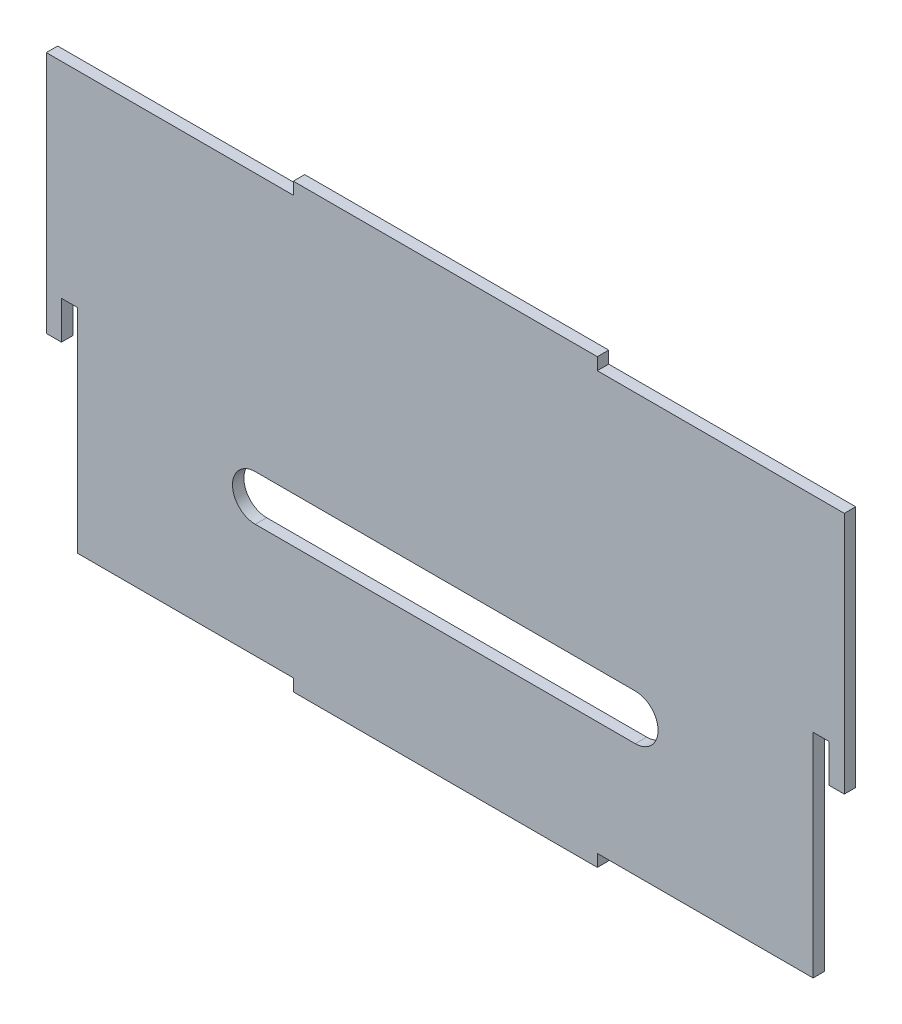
SolidWorks part; units mm, degrees
ref_plane "Plan de face" through (0, 0, 0) normal (0, 0, 1) x (1, 0, 0)
ref_plane "Plan de dessus" through (0, 0, 0) normal (0, 1, 0) x (1, 0, 0)
ref_plane "Plan de droite" through (0, 0, 0) normal (1, 0, 0) x (0, 0, -1)
sketch "Esquisse1" plane through (0, 0, 0) normal (0, 0, 1) x (1, 0, 0)
  line L0 (-52.5, 27.5) -> (52.5, -27.5) construction
  line L2 (-52.5, 27.5) -> (-52.5, -27.5)
  line L3 (-52.5, -27.5) -> (-50.5, -27.5)
  line L4 (52.5, 27.5) -> (52.5, -27.5)
  line L5 (0, 0) -> (0, -53.5236) construction
  line L7 (-20, -27.5) -> (-20, -29.1)
  line L8 (-20, -29.1) -> (20, -29.1)
  line L9 (20, -27.5) -> (20, -29.1)
  line L10 (20, -27.5) -> (48.4, -27.5)
  line L19 (-52.5, 27.5) -> (-20, 27.5)
  line L21 (0, 0) -> (24.5194, 0) construction
  line L22 (20, 27.5) -> (20, 29.1)
  line L23 (-20, 29.1) -> (20, 29.1)
  line L24 (-20, 27.5) -> (-20, 29.1)
  line L25 (20, 27.5) -> (52.5, 27.5)
  line L26 (50.5, 0.5) -> (48.4, 0.5)
  line L28 (-50.5, -27.5) -> (-50.5, 0.5)
  line L29 (-50.5, 0.5) -> (-48.4, 0.5)
  line L30 (-48.4, -27.5) -> (-48.4, 0.5)
  line L31 (48.4, -27.5) -> (48.4, 0.5)
  line L32 (50.5, -27.5) -> (50.5, 0.5)
  line L33 (-48.4, -27.5) -> (-20, -27.5)
  line L34 (50.5, -27.5) -> (52.5, -27.5)
  dimension "D1" = 55
  dimension "D2" = 105
  dimension "D3" = 40
  dimension "D4" = 1.6
  dimension "D5" = 28
  dimension "D6" = 2.1
  dimension "D7" = 2
extrude "Boss.-Extru.1" add sketch "Esquisse1" along normal blind 1.5
sketch "Esquisse2" plane through (0, 0, 0) normal (0, 0, 1) x (1, 0, 0)
  line L0 (-25, -9.5) -> (25, -9.5) construction
  line L1 (-25, -6.5) -> (25, -6.5)
  line L2 (-25, -12.5) -> (25, -12.5)
  line L3 (0, 0) -> (0, 35.5466) construction
  line L4 (-48.4, -27.5) -> (-20, -27.5) construction
  arc A0 (-25, -6.5) -> (-25, -12.5) centre (-25, -9.5) ccw
  arc A1 (25, -12.5) -> (25, -6.5) centre (25, -9.5) ccw
  point P2 (0, -9.5)
  point P10 (0, 0)
  dimension "D1" = 50
  dimension "D2" = 6
  dimension "D3" = 15
extrude "Enlèv. mat.-Extru.2" cut sketch "Esquisse2" along normal blind 10 contours L1 A1 L2 A0
sketch "Esquisse3" plane through (0, 0, 1.5) normal (0, 0, 1) x (1, 0, 0)
  line L0 (-50.5, -27.5) -> (-50.5, 0.5) construction
  line L1 (-52.5, -27.5) -> (-50.5, -27.5)
  line L2 (-52.5, -27.5) -> (-52.5, -4.5)
  line L3 (-52.5, -4.5) -> (-50.5, -4.5)
  line L4 (-50.5, -27.5) -> (-50.5, -4.5)
  line L5 (0, 0) -> (0, -35.1822) construction
  line L6 (50.5, -27.5) -> (50.5, -4.5)
  line L7 (52.5, -4.5) -> (50.5, -4.5)
  line L8 (52.5, -27.5) -> (52.5, -4.5)
  line L9 (52.5, -27.5) -> (50.5, -27.5)
  dimension "D1" = 5
extrude "Enlèv. mat.-Extru.3" cut sketch "Esquisse3" against normal blind 10
